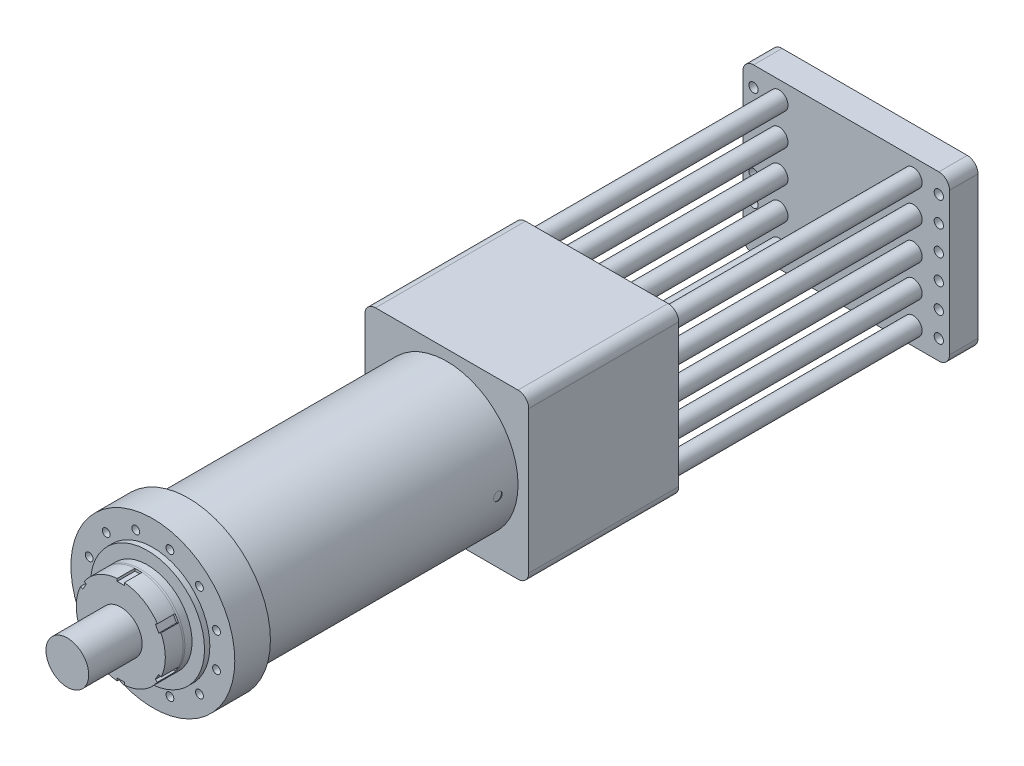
SolidWorks part; units mm, degrees
ref_plane "前视基准面" through (0, 0, 0) normal (0, 0, 1) x (1, 0, 0)
ref_plane "上视基准面" through (0, 0, 0) normal (0, 1, 0) x (1, 0, 0)
ref_plane "右视基准面" through (0, 0, 0) normal (1, 0, 0) x (0, 0, -1)
sketch "草图1" plane through (0, 0, 0) normal (0, 0, 1) x (1, 0, 0)
  circle A0 centre (0, 0) radius 200
  dimension "D1" = 400
extrude "凸台-拉伸1" add sketch "草图1" along normal blind 725
sketch "草图2" plane through (0, 0, 725) normal (0, 0, 1) x (1, 0, 0)
  line L0 (0, 0) -> (351.3656, 0) construction
  line L1 (0, 0) -> (299.4379, 80.2342) construction
  circle A0 centre (0, 0) radius 230
  circle A1 centre (0, 0) radius 185 construction
  circle A2 centre (178.6963, 47.8815) radius 11
  circle A3 centre (178.6963, -47.8815) radius 11
  circle A4 centre (130.8148, -130.8148) radius 11
  circle A5 centre (47.8815, -178.6963) radius 11
  circle A6 centre (-47.8815, -178.6963) radius 11
  circle A7 centre (-130.8148, -130.8148) radius 11
  circle A8 centre (-178.6963, -47.8815) radius 11
  circle A9 centre (-178.6963, 47.8815) radius 11
  circle A10 centre (-130.8148, 130.8148) radius 11
  circle A11 centre (-47.8815, 178.6963) radius 11
  circle A12 centre (47.8815, 178.6963) radius 11
  circle A13 centre (130.8148, 130.8148) radius 11
  point P32 (0, 0)
  dimension "D1" = 460
  dimension "D2" = 370
  dimension "D4" = 22
  dimension "D3" = 15
  dimension "D5" = 12
extrude "凸台-拉伸2" add sketch "草图2" along normal blind 100
sketch "草图3" plane through (0, 0, 825) normal (0, 0, 1) x (1, 0, 0)
  circle A0 centre (0, 0) radius 160
  dimension "D1" = 320
extrude "凸台-拉伸3" add sketch "草图3" along normal blind 15
sketch "草图4" plane through (0, 0, 840) normal (0, 0, 1) x (1, 0, 0)
  circle A1 centre (0, 0) radius 125
  dimension "D1" = 250
extrude "凸台-拉伸4" add sketch "草图4" along normal blind 25
chamfer "倒角1" distance 5 angle 10 1 edges at (125, 0, 865)
sketch "草图5" plane through (0, 0, 865) normal (0, 0, 1) x (1, 0, 0)
  line L0 (-10, 124.5994) -> (-10, 117.5)
  line L1 (-10, 117.5) -> (10, 117.5)
  line L2 (10, 117.5) -> (10, 124.5994)
  line L3 (102.9062, 70.9599) -> (96.758, 67.4103)
  line L4 (96.758, 67.4103) -> (106.758, 50.0897)
  line L5 (106.758, 50.0897) -> (112.9062, 53.6394)
  line L6 (112.9062, -53.6394) -> (106.758, -50.0897)
  line L7 (106.758, -50.0897) -> (96.758, -67.4103)
  line L8 (96.758, -67.4103) -> (102.9062, -70.9599)
  line L9 (10, -124.5994) -> (10, -117.5)
  line L10 (10, -117.5) -> (-10, -117.5)
  line L11 (-10, -117.5) -> (-10, -124.5994)
  line L12 (-102.9062, -70.9599) -> (-96.758, -67.4103)
  line L13 (-96.758, -67.4103) -> (-106.758, -50.0897)
  line L14 (-106.758, -50.0897) -> (-112.9062, -53.6394)
  line L15 (-112.9062, 53.6394) -> (-106.758, 50.0897)
  line L16 (-106.758, 50.0897) -> (-96.758, 67.4103)
  line L17 (-96.758, 67.4103) -> (-102.9062, 70.9599)
  arc A0 (-10, 124.5994) -> (-102.9062, 70.9599) centre (0, 0) ccw
  arc A1 (-112.9062, 53.6394) -> (-112.9062, -53.6394) centre (0, 0) ccw
  arc A2 (-102.9062, -70.9599) -> (-10, -124.5994) centre (0, 0) ccw
  arc A3 (10, -124.5994) -> (102.9062, -70.9599) centre (0, 0) ccw
  arc A4 (112.9062, -53.6394) -> (112.9062, 53.6394) centre (0, 0) ccw
  arc A5 (102.9062, 70.9599) -> (10, 124.5994) centre (0, 0) ccw
  point P28 (0, 0)
  dimension "D1" = 250
  dimension "D2" = 20
  dimension "D3" = 10
  dimension "D4" = 117.5
  dimension "D5" = 6
sketch "草图6" plane through (0, 0, 0) normal (0, 0, -1) x (-1, 0, 0)
  line L1 (-230, 230) -> (230, 230)
  line L2 (-230, 230) -> (-230, -230)
  line L3 (-230, -230) -> (230, -230)
  line L4 (230, 230) -> (230, -230)
  line L5 (-230, 230) -> (230, -230) construction
  line L6 (-230, -230) -> (230, 230) construction
  circle A0 centre (0, 0) radius 230 construction
  dimension "D1" = 460
  dimension "D2" = 460
  dimension "D3" = 460
extrude "凸台-拉伸6" add sketch "草图6" along normal blind 421
ref_plane "基准面1" through (-200, 0, 0) normal (1, 0, 0) x (0, 0, -1)
sketch "草图9" plane through (-200, 0, 0) normal (1, 0, 0) x (0, 0, -1)
  line L0 (-725, -200) -> (-725, 200) construction
  circle A0 centre (-36.5, 0) radius 12
  circle A1 centre (-670.5, 0) radius 12
  dimension "D1" = 24
  dimension "D2" = 24
  dimension "D3" = 36.5
  dimension "D4" = 54.5
extrude "切除-拉伸2" cut sketch "草图9" along normal blind 2
ref_plane "基准面2" through (200, 0, 0) normal (1, 0, 0) x (0, 0, -1)
sketch "草图10" plane through (200, 0, 0) normal (1, 0, 0) x (0, 0, -1)
  circle A0 centre (-56.5, 0) radius 12
  dimension "D1" = 56.5
  dimension "D2" = 24
extrude "切除-拉伸3" cut sketch "草图10" against normal blind 2
extrude "凸台-拉伸7" add sketch "草图5" along normal blind 50
sketch "草图11" plane through (0, 0, 915) normal (0, 0, 1) x (1, 0, 0)
  circle A0 centre (0, 0) radius 60
  dimension "D1" = 120
extrude "凸台-拉伸8" add sketch "草图11" along normal blind 150
sketch "草图12" plane through (0, 0, -421) normal (0, 0, -1) x (-1, 0, 0)
  line L0 (0, 0) -> (0, 115.5989) construction
  line L1 (-230, -230) -> (230, -230) construction
  circle A0 centre (-188.2698, 180) radius 25
  circle A1 centre (-188.2698, 90) radius 25
  circle A2 centre (-188.2698, 0) radius 25
  circle A3 centre (-188.2698, -90) radius 25
  circle A4 centre (-188.2698, -180) radius 25
  circle A5 centre (188.2698, -180) radius 25
  circle A6 centre (188.2698, -90) radius 25
  circle A7 centre (188.2698, 0) radius 25
  circle A8 centre (188.2698, 90) radius 25
  circle A9 centre (188.2698, 180) radius 25
  point P13 (0, 0)
  dimension "D1" = 50
  dimension "D2" = 50
  dimension "D3" = 90
  dimension "D4" = 90
  dimension "D5" = 90
  dimension "D6" = 90
extrude "凸台-拉伸9" add sketch "草图12" along normal blind 700
sketch "草图13" plane through (0, 0, -1121) normal (0, 0, -1) x (-1, 0, 0)
  line L0 (0, 0) -> (0, -81.9096) construction
  line L1 (-290, 230) -> (290, 230)
  line L2 (-290, 230) -> (-290, -230)
  line L3 (-290, -230) -> (290, -230)
  line L4 (290, 230) -> (290, -230)
  line L5 (-290, 230) -> (290, -230) construction
  line L6 (-290, -230) -> (290, 230) construction
  circle A0 centre (-260, 175) radius 13
  circle A1 centre (-260, 105) radius 13
  circle A2 centre (-260, -35) radius 13
  circle A3 centre (-260, -105) radius 13
  circle A4 centre (-260, -175) radius 13
  circle A5 centre (-260, 35) radius 13
  circle A6 centre (260, -175) radius 13
  circle A7 centre (260, -105) radius 13
  circle A8 centre (260, -35) radius 13
  circle A9 centre (260, 35) radius 13
  circle A10 centre (260, 105) radius 13
  circle A11 centre (260, 175) radius 13
  point P0 (0, 0)
  dimension "D3" = 26
  dimension "D1" = 580
  dimension "D2" = 460
  dimension "D4" = 260
  dimension "D5" = 55
  dimension "D6" = 55
  dimension "D7" = 70
  dimension "D8" = 210
  dimension "D9" = 70
  dimension "D10" = 70
extrude "凸台-拉伸10" add sketch "草图13" along normal blind 80
fillet "圆角1" radius 30 8 edges at (290, -230, -1161) (230, -230, -210.5) (290, 230, -1161) (230, 230, -210.5) (-290, -230, -1161) (-230, -230, -210.5) (-290, 230, -1161) (-230, 230, -210.5)
